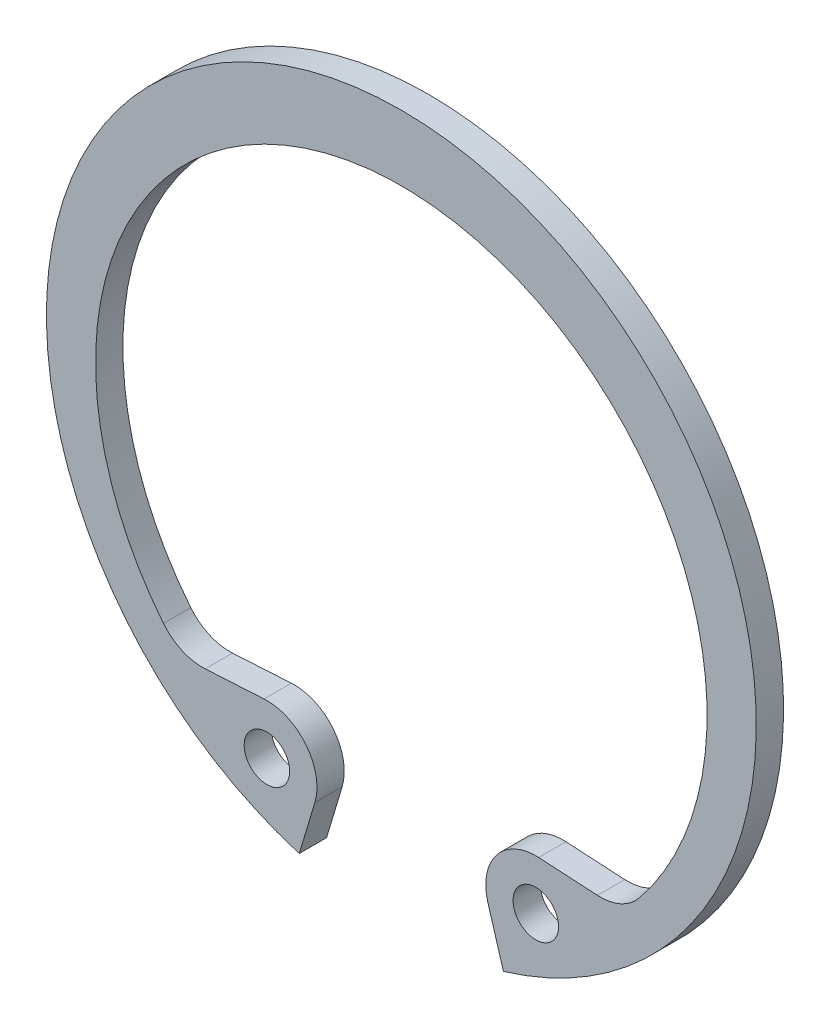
SolidWorks part; units mm, degrees
ref_plane "Face" through (0, 0, 0) normal (0, 0, 1) x (1, 0, 0)
ref_plane "Dessus" through (0, 0, 0) normal (0, 1, 0) x (1, 0, 0)
ref_plane "Droite" through (0, 0, 0) normal (1, 0, 0) x (0, 0, -1)
sketch "Esquisse1" plane through (0, 0, 0) normal (0, 0, 1) x (1, 0, 0)
  line L0 (0, 15.9) -> (0, 19.5) construction
  line L1 (4.7529, -15.8243) -> (5.6094, -18.6758)
  line L2 (6.174, -12.5651) -> (8.5994, -17.5014) construction
  line L3 (10.7732, -12.473) -> (7.5441, -12.2878)
  line L4 (-10.7732, -12.473) -> (-7.5441, -12.2878)
  line L5 (-4.7529, -15.8243) -> (-5.6094, -18.6758)
  line L6 (5.7879, -15.9021) -> (6.8062, -18.6999) construction
  line L7 (-5.7879, -15.9021) -> (-6.8062, -18.6999) construction
  arc A0 (5.6094, -18.6758) -> (-5.6094, -18.6758) centre (0, 0) ccw
  arc A1 (13.0701, -11.4553) -> (-13.0701, -11.4553) centre (0, -0.9) ccw
  arc A2 (7.5441, -12.2878) -> (4.7529, -15.8243) centre (7.3867, -15.0333) ccw
  arc A3 (10.7732, -12.473) -> (13.0701, -11.4553) centre (10.9306, -9.7275) ccw
  circle A4 centre (7.3867, -15.0333) radius 1.25
  arc A5 (-10.7732, -12.473) -> (-13.0701, -11.4553) centre (-10.9306, -9.7275) cw
  circle A6 centre (-7.3867, -15.0333) radius 1.25
  arc A7 (-7.5441, -12.2878) -> (-4.7529, -15.8243) centre (-7.3867, -15.0333) cw
  arc A8 (6.8062, -18.6999) -> (-6.8062, -18.6999) centre (0, 0) ccw construction
  circle A9 centre (0, 0) radius 18.5 construction
  dimension "dgorge" = 39
  dimension "D3" = 0.9
  dimension "dtrou" = 2.5
  dimension "dext" = 39.8
  dimension "dn" = 37
  dimension "b" = 3.6
  dimension "a" = 5.5
  dimension "D5" = 70
  dimension "D7" = 33.436
  dimension "D9" = 40
extrude "Base-Extrusion" add sketch "Esquisse1" along normal blind 1.5
equation "\"D3@Esquisse1\" = \"b@Esquisse1\"/4"
equation "\"D7@Esquisse1\" = 360-(360-\"D9@Esquisse1\")*\"dext@Esquisse1\"/\"dgorge@Esquisse1\""
